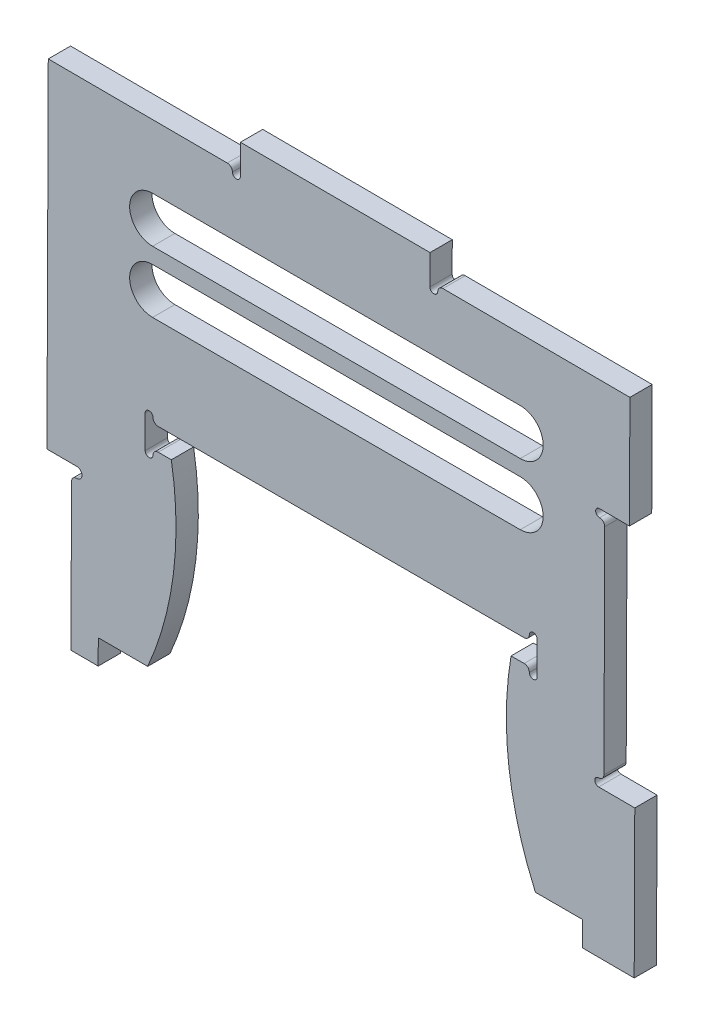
SolidWorks part; units mm, degrees
ref_plane "Front Plane" through (0, 0, 0) normal (0, 0, 1) x (1, 0, 0)
ref_plane "Top Plane" through (0, 0, 0) normal (0, 1, 0) x (1, 0, 0)
ref_plane "Right Plane" through (0, 0, 0) normal (1, 0, 0) x (0, 0, -1)
sketch "Sketch2" plane through (0, 0, 0) normal (0, 0, 1) x (1, 0, 0)
  line L0 (77.9293, 327.4579) -> (358.3003, 327.4579) construction
  line L1 (77.9293, 344.9579) -> (358.3003, 344.9579)
  line L2 (77.9293, 309.9579) -> (358.3003, 309.9579)
  line L3 (-1.9791, 303.9579) -> (415.8303, 303.9579) construction
  line L4 (77.9293, 280.4579) -> (358.3003, 280.4579) construction
  line L5 (77.9293, 262.9579) -> (358.3003, 262.9579)
  line L6 (77.9293, 297.9579) -> (358.3003, 297.9579)
  line L7 (92.2222, 176.1047) -> (82.2222, 176.1047)
  line L8 (72.2651, 172.1476) -> (72.2651, 197.0577)
  line L9 (82.2222, 193.1007) -> (361.2933, 193.1007)
  line L10 (371.2504, 197.0577) -> (371.2504, 172.1476)
  line L11 (361.2933, 176.1047) -> (351.2933, 176.1047)
  line L12 (92.2222, 176.1047) -> (351.2933, 176.1047) construction
  line L13 (405.6422, 29.2862) -> (405.6422, 10.4902)
  line L14 (405.6422, 10.4902) -> (445.2124, 10.335)
  line L15 (445.2124, 10.335) -> (445.654, 122.8672)
  line L16 (445.654, 122.8672) -> (418.1159, 122.9752)
  line L17 (422.112, 132.9167) -> (422.7564, 297.1331)
  line L18 (418.8384, 307.1056) -> (441.5913, 307.0163)
  line L19 (441.5913, 307.0163) -> (441.9255, 392.1914)
  line L20 (441.9255, 392.1914) -> (299.3653, 392.7508)
  line L21 (289.3928, 388.8328) -> (289.482, 411.5857)
  line L22 (289.482, 411.5857) -> (144.922, 412.168)
  line L23 (144.922, 412.168) -> (144.8328, 389.4151)
  line L24 (134.8913, 393.4112) -> (-1.626, 393.9469)
  line L25 (-1.626, 393.9469) -> (-2.6391, 135.7512)
  line L26 (-2.6391, 135.7512) -> (20.1138, 135.6619)
  line L27 (16.1101, 123.8064) -> (15.6715, 12.0205)
  line L28 (15.6715, 12.0205) -> (36.4459, 11.939)
  line L29 (36.4459, 11.939) -> (36.5196, 30.7348)
  line L30 (46.4766, 30.6958) -> (74.1758, 30.5871)
  line L31 (221.7577, 193.1007) -> (221.7577, 237.3809) construction
  line L32 (46.4766, 30.6958) -> (36.5196, 30.7348)
  line L33 (395.6851, 29.2862) -> (370.2101, 29.2862)
  line L34 (395.6851, 29.2862) -> (405.6422, 29.2862)
  line L35 (-2.204, 246.6463) -> (422.5582, 246.6463) construction
  arc A0 (77.9293, 344.9579) -> (77.9293, 309.9579) centre (77.9293, 327.4579) ccw
  arc A1 (358.3003, 309.9579) -> (358.3003, 344.9579) centre (358.3003, 327.4579) ccw
  arc A2 (77.9293, 262.9579) -> (77.9293, 297.9579) centre (77.9293, 280.4579) cw
  arc A3 (358.3003, 297.9579) -> (358.3003, 262.9579) centre (358.3003, 280.4579) cw
  arc A4 (82.2222, 176.1047) -> (78.2651, 172.1476) centre (82.2222, 172.1476) ccw
  arc A5 (72.2651, 172.1476) -> (78.2651, 172.1476) centre (75.2651, 172.1476) ccw
  arc A6 (78.2651, 197.0577) -> (72.2651, 197.0577) centre (75.2651, 197.0577) ccw
  arc A7 (78.2651, 197.0577) -> (82.2222, 193.1007) centre (82.2222, 197.0577) ccw
  arc A8 (361.2933, 193.1007) -> (365.2504, 197.0577) centre (361.2933, 197.0577) ccw
  arc A9 (371.2504, 197.0577) -> (365.2504, 197.0577) centre (368.2504, 197.0577) ccw
  arc A10 (365.2504, 172.1476) -> (371.2504, 172.1476) centre (368.2504, 172.1476) ccw
  arc A11 (365.2504, 172.1476) -> (361.2933, 176.1047) centre (361.2933, 172.1476) ccw
  arc A12 (74.1758, 30.5871) -> (92.2222, 176.1047) centre (-159.4891, 133.4429) ccw
  arc A13 (369.3397, 30.5871) -> (351.2933, 176.1047) centre (603.0046, 133.4429) cw
  arc A14 (418.1394, 128.9752) -> (418.1159, 122.9752) centre (418.1277, 125.9752) ccw
  arc A15 (418.1394, 128.9752) -> (422.112, 132.9167) centre (418.1549, 132.9322) ccw
  arc A16 (422.7564, 297.1331) -> (418.8149, 301.1056) centre (418.7993, 297.1486) ccw
  arc A17 (418.8384, 307.1056) -> (418.8149, 301.1056) centre (418.8266, 304.1056) ccw
  arc A18 (299.3653, 392.7508) -> (295.3927, 388.8093) centre (299.3497, 388.7937) ccw
  arc A19 (289.3928, 388.8328) -> (295.3927, 388.8093) centre (292.3927, 388.821) ccw
  arc A20 (138.8328, 389.4386) -> (144.8328, 389.4151) centre (141.8328, 389.4269) ccw
  arc A21 (138.8328, 389.4386) -> (134.8913, 393.4112) centre (134.8758, 389.4542) ccw
  arc A22 (20.0827, 127.7479) -> (20.1138, 135.6619) centre (20.0982, 131.7049) ccw
  arc A23 (20.0827, 127.7479) -> (16.1101, 123.8064) centre (20.0672, 123.7908) ccw
  arc A24 (369.3397, 30.5871) -> (370.2101, 29.2862) centre (370.7302, 30.5758) ccw
  point P3 (218.1148, 327.4579)
  point P12 (218.1148, 280.4579)
extrude "Boss-Extrude1" add sketch "Sketch2" along normal blind 17
equation "\"EndMill_HalfDiameter\"=3"
equation "\"WoodThickness\"= 17mm"
equation "\"D1@Boss-Extrude1\"=\"WoodThickness\""
equation "\"InnerLengthControl\"=10"
equation "\"D6@Sketch2\"=\"EndMill_HalfDiameter\""
equation "\"D7@Sketch2\"=\"EndMill_HalfDiameter\""
equation "\"D8@Sketch2\"=\"EndMill_HalfDiameter\""
equation "\"D9@Sketch2\"=\"InnerLengthControl\""
equation "\"D4@Sketch2\"=\"EndMill_HalfDiameter\""
